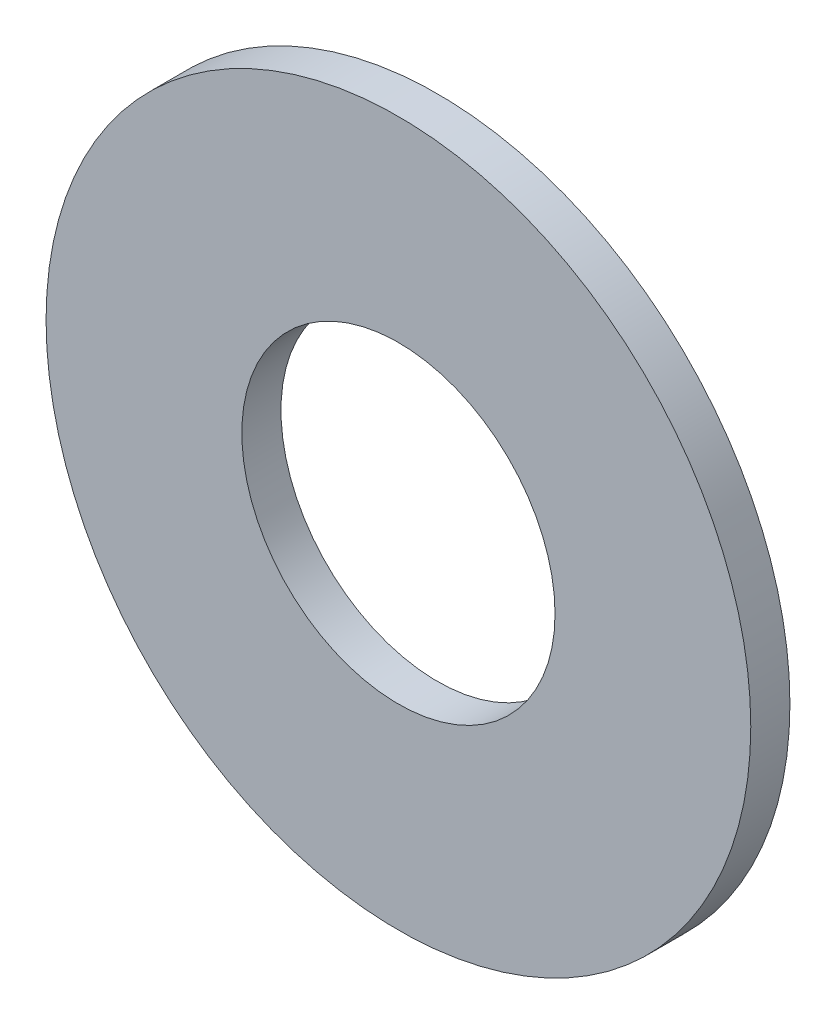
SolidWorks part; units mm, degrees
ref_plane "Plan1" through (0, 0, 0) normal (0, 0, 1) x (1, 0, 0)
ref_plane "Plan2" through (0, 0, 0) normal (0, 1, 0) x (1, 0, 0)
ref_plane "Plan3" through (0, 0, 0) normal (1, 0, 0) x (0, 0, -1)
sketch "Esquisse1" plane through (0, 0, 0) normal (0, 0, 1) x (1, 0, 0)
  line L0 (0, 10) -> (0, -10) construction
  line L1 (-10, 0) -> (10, 0) construction
  circle A0 centre (0, 0) radius 4
  circle A1 centre (0, 0) radius 9
  dimension "D1" = 8
  dimension "D2" = 18
extrude "Base-Extrusion" add sketch "Esquisse1" along normal blind 1
